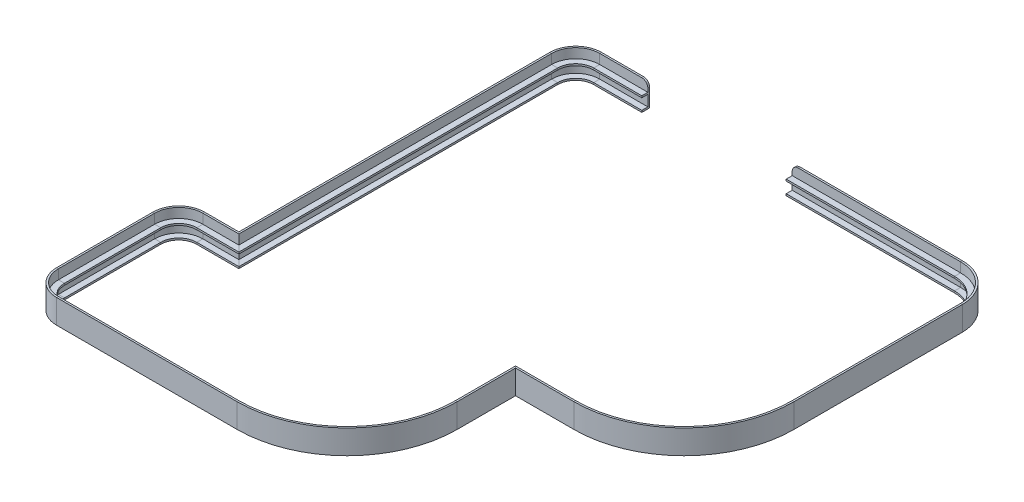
SolidWorks part; units mm, degrees
ref_plane "Front Plane" through (0, 0, 0) normal (0, 0, 1) x (1, 0, 0)
ref_plane "Top Plane" through (0, 0, 0) normal (0, 1, 0) x (1, 0, 0)
ref_plane "Right Plane" through (0, 0, 0) normal (1, 0, 0) x (0, 0, -1)
body saved out of another part "Stock-V1-1"
move or copy body "Body-Move/Copy1" bodies to move or copy 101 copy no rotation origin (-115, 0, -50) rotation axis (0, 1, 0) rotation angle 180
